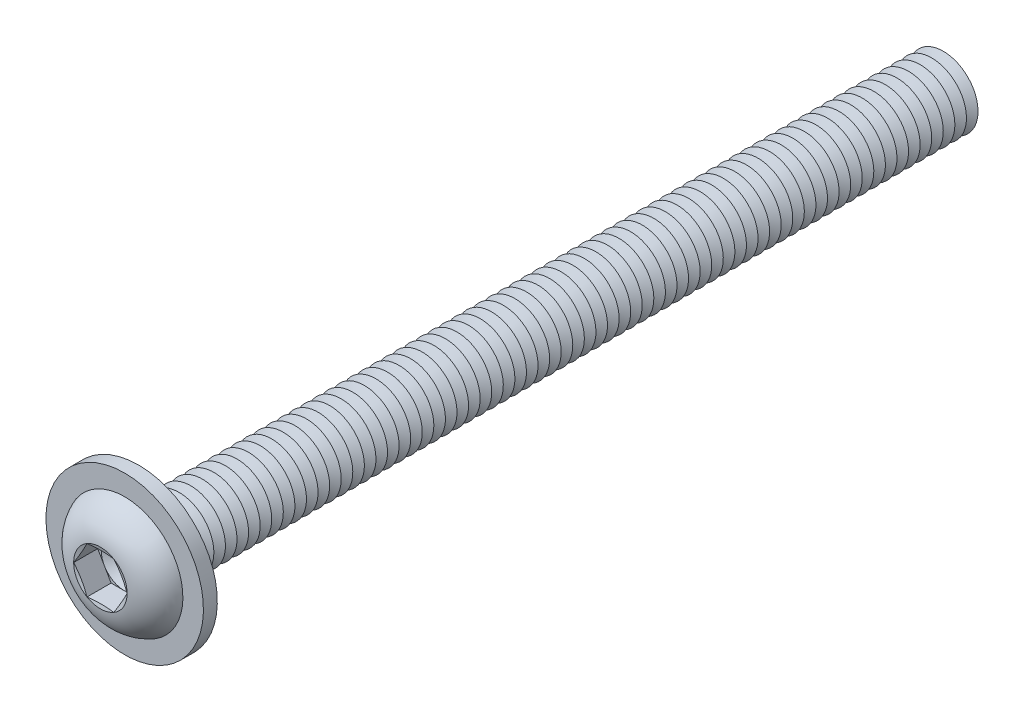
SolidWorks part; units mm, degrees
ref_plane "Front Plane" through (0, 0, 0) normal (0, 0, 1) x (1, 0, 0)
ref_plane "Top Plane" through (0, 0, 0) normal (0, 1, 0) x (1, 0, 0)
ref_plane "Right Plane" through (0, 0, 0) normal (1, 0, 0) x (0, 0, -1)
sketch "Sketch1" plane through (0, 0, 0) normal (1, 0, 0) x (0, 0, -1)
  line L0 (0, 3) -> (0, 5.25)
  line L3 (0, 3) -> (70, 3)
  line L4 (70, 3) -> (70, 0)
  line L5 (70, 0) -> (-3.3, 0) construction
  line L6 (-3.3, 0) -> (70, 0)
  line L7 (-3.3, 2.3094) -> (-3.3, 1.1547) construction
  line L8 (-3.3, 1.1547) -> (-3.3, 0)
  line L9 (-3.3, 2.3094) -> (-2.9906, 1.1547)
  line L10 (-2.9906, 1.1547) -> (-3.3, 1.1547)
  line L11 (70, 0) -> (22.7481, 0) construction
  line L12 (0, 5.25) -> (-3.3, 5.25) construction
  arc A1 (0, 5.25) -> (-3.3, 2.3094) centre (0, 1.928) ccw
  point P8 (70, 1.5)
  dimension "D1" = 10.5
  dimension "D2" = 6
  dimension "D3" = 3.3
  dimension "D4" = 4.6188
  dimension "D5" = 70
  dimension "D6" = 15
revolve "Revolve1" add sketch "Sketch1" angle 360 about L5
fillet "Fillet1" radius 0.5 1 edges at (0, 3, 0)
sketch "Sketch2" plane through (0, 0, 0) normal (1, 0, 0) x (0, 0, -1)
  line L0 (69.5, 3) -> (70.5, 3)
  line L1 (70, 3) -> (0.5, 3) construction
  line L2 (70.5, 3) -> (70, 2.134)
  line L3 (70, -3) -> (70, 3) construction
  line L4 (70, 2.134) -> (69.5, 3)
  dimension "D1" = 1
revolve "Cut-Revolve1" cut sketch "Sketch2" angle 360 about axis through (0, 0, -70) along (0, 0, -1)
pattern_linear "LPattern1" count 70 spacing 1 along (0, 0, 1) of "Cut-Revolve1"
sketch "Sketch3" plane through (0, 0, 3.3) normal (0, 0, 1) x (1, 0, 0)
  line L7 (1.1547, 2) -> (-1.1547, 2)
  line L8 (-1.1547, 2) -> (-2.3094, 0)
  line L9 (-2.3094, 0) -> (-1.1547, -2)
  line L10 (-1.1547, -2) -> (1.1547, -2)
  line L11 (1.1547, -2) -> (2.3094, 0)
  line L12 (2.3094, 0) -> (1.1547, 2)
  circle A0 centre (0, 0) radius 2 construction
  circle A3 centre (0, 0) radius 2.3094 construction
extrude "Cut-Extrude1" cut sketch "Sketch3" against normal blind 2.08
sketch "Sketch4" plane through (0, 0, 1.22) normal (0, 0, 1) x (1, 0, 0)
  line L1 (1.1547, 2) -> (-1.1547, 2) construction
  circle A0 centre (0, 0) radius 2
extrude "Cut-Extrude2" cut sketch "Sketch4" against normal through all draft 60
sketch "Sketch5" plane through (0, 0, 0) normal (0, 0, -1) x (-1, 0, 0)
  circle A0 centre (0, 0) radius 6.8
  circle A1 centre (0, 0) radius 3.5
  circle A2 centre (0, 0) radius 3.5 construction
  dimension "D1" = 13.6
extrude "Boss-Extrude1" add sketch "Sketch5" against normal blind 1.2
